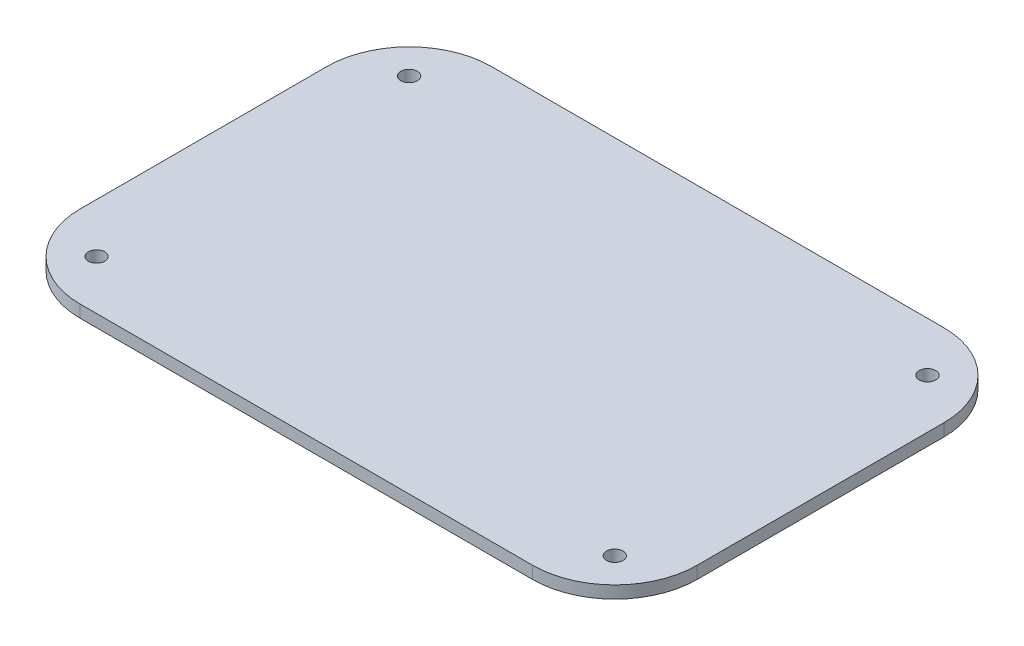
SolidWorks part; units mm, degrees
ref_plane "Front Plane" through (0, 0, 0) normal (0, 0, 1) x (1, 0, 0)
ref_plane "Top Plane" through (0, 0, 0) normal (0, 1, 0) x (1, 0, 0)
ref_plane "Right Plane" through (0, 0, 0) normal (1, 0, 0) x (0, 0, -1)
sketch "Sketch1" plane through (0, 0, 0) normal (0, 1, 0) x (1, 0, 0)
  line L1 (-55, 50) -> (55, 50)
  line L2 (-75, 30) -> (-75, -30)
  line L3 (-55, -50) -> (55, -50)
  line L4 (75, 30) -> (75, -30)
  line L5 (-75, 50) -> (75, -50) construction
  line L6 (-75, -50) -> (75, 50) construction
  arc A0 (-75, -30) -> (-55, -50) centre (-55, -30) ccw
  arc A1 (55, -50) -> (75, -30) centre (55, -30) ccw
  arc A2 (55, 50) -> (75, 30) centre (55, 30) cw
  arc A3 (-75, 30) -> (-55, 50) centre (-55, 30) cw
  point P0 (0, 0)
  dimension "D3" = 20
  dimension "D1" = 150
  dimension "D2" = 100
extrude "Boss-Extrude1" add sketch "Sketch1" along normal blind 3
sketch "Sketch3" plane through (0, 3, 0) normal (0, 1, 0) x (1, 0, 0)
  line L0 (75, -30) -> (75, 30) construction
  line L1 (55, 50) -> (-55, 50) construction
  circle A0 centre (63, 38) radius 2
  dimension "D1" = 12
  dimension "D2" = 12
  dimension "D3" = 4
extrude "Cut-Extrude1" cut sketch "Sketch3" against normal blind 10
mirror "Mirror1" about plane through (0, 0, 0) normal (0, 0, 1) of "Cut-Extrude1"
mirror "Mirror2" about plane through (0, 0, 0) normal (1, 0, 0) of "Mirror1", "Cut-Extrude1"
